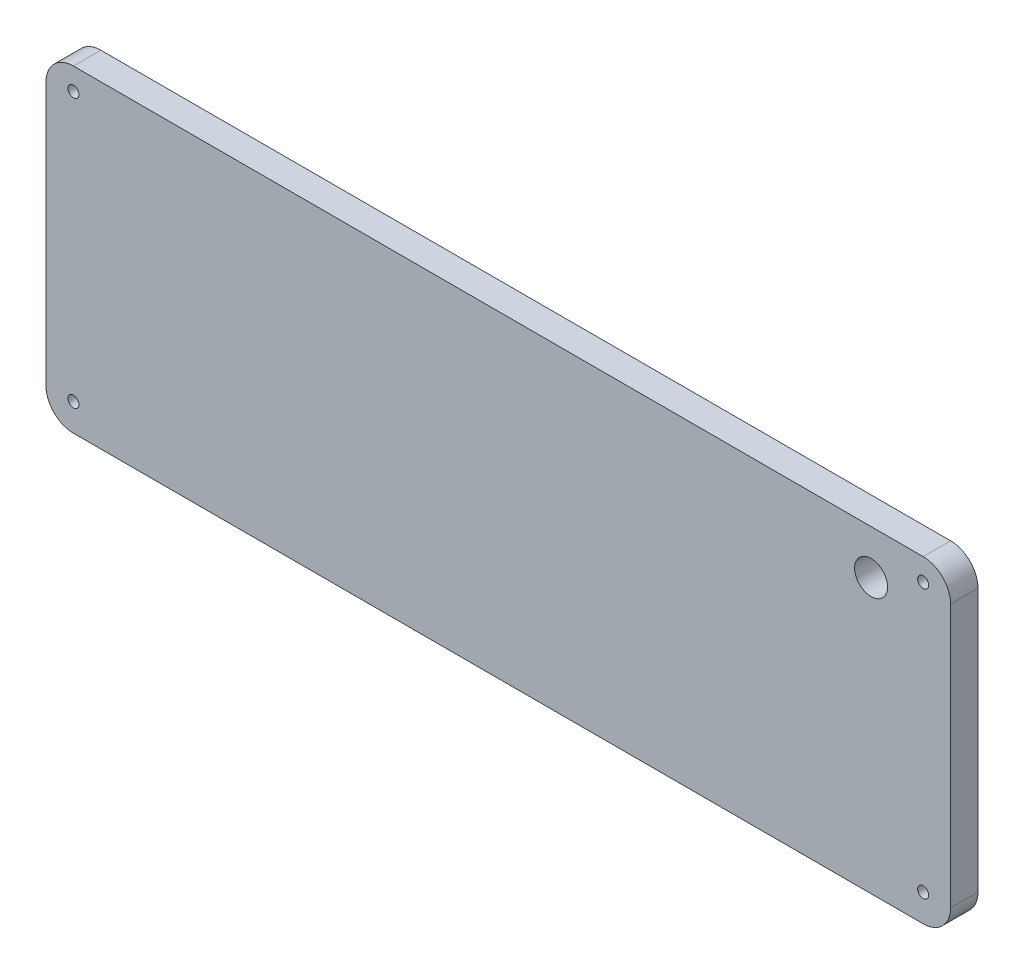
SolidWorks part; units mm, degrees
other "<底板>-<<网格板>-<切除-拉伸4>>"
ref_plane "Front" through (0, 0, 0) normal (0, 0, 1) x (1, 0, 0)
ref_plane "Top" through (0, 0, 0) normal (0, 1, 0) x (1, 0, 0)
ref_plane "Right" through (0, 0, 0) normal (1, 0, 0) x (0, 0, -1)
inserted part "底板"
sketch "草图2" plane through (0, 0, 42.5871) normal (0, 0, -1) x (-1, 0, 0)
  line L0 (-77.3919, 37.0088) -> (-61.5919, 37.0088) construction
  line L1 (-53.6919, 37.0088) -> (-69.4919, 37.0088)
  line L3 (-69.4919, 37.0088) -> (-53.6919, 37.0088)
  circle A0 centre (-61.5919, 37.0088) radius 6.0143
  point P0 (-69.4919, 37.0088)
  point P7 (-61.5919, 37.0088)
sketch "草图3" plane through (0, 0, 42.5871) normal (0, 0, -1) x (-1, 0, 0)
  line L1 (-80.5207, 38.9281) -> (229.4958, 38.9281)
  line L2 (-80.5207, 38.9281) -> (-80.5207, -49.6005)
  line L3 (-80.5207, -49.6005) -> (229.4958, -49.6005)
  line L4 (229.4958, 38.9281) -> (229.4958, -49.6005)
extrude "凸台-拉伸1" add sketch "草图3" against normal blind 10
extrude "切除-拉伸1" cut sketch "草图2" against normal blind 10 contours L3 A0 | L3 A0 M3 | A0 L3 M3
